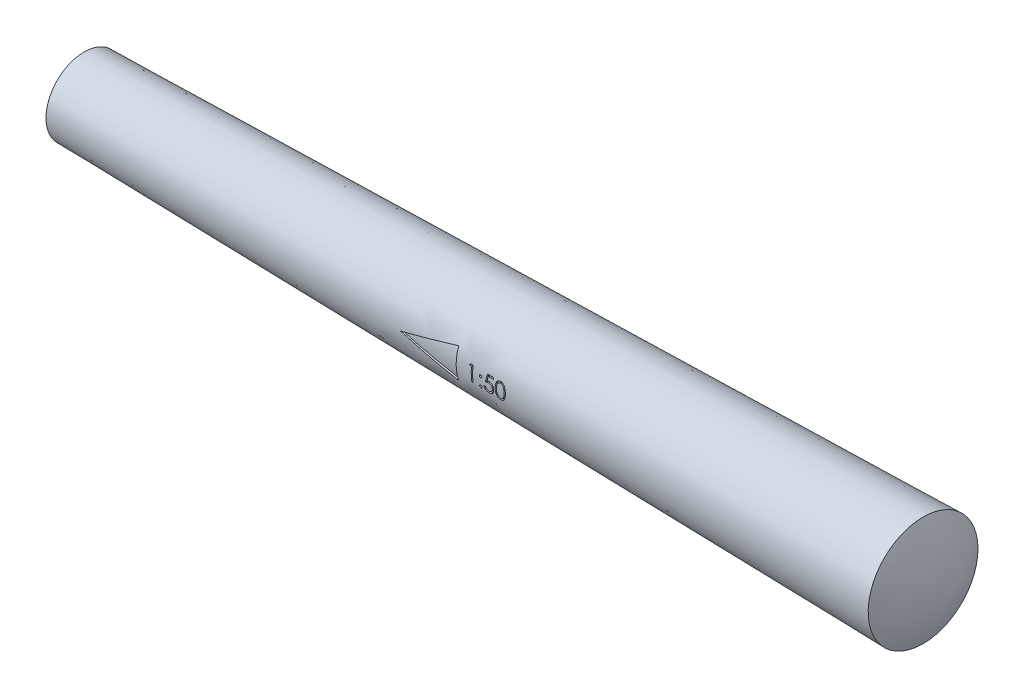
SolidWorks part; units mm, degrees
ref_plane "Front Plane" through (0, 0, 0) normal (0, 0, 1) x (1, 0, 0)
ref_plane "Top Plane" through (0, 0, 0) normal (0, 1, 0) x (1, 0, 0)
ref_plane "Right Plane" through (0, 0, 0) normal (1, 0, 0) x (0, 0, -1)
sketch "Sketch1" plane through (0, 0, 0) normal (1, 0, 0) x (0, 0, -1)
  circle A0 centre (0, 0) radius 2.5
  dimension "D1" = 5
extrude "Extrude1" add sketch "Sketch1" along normal mid plane 55
draft "Draft1" type of draft neutral plane draft angle 1.146 faces to draft 1 parameters "D1"=1.146
sketch "Sketch2" plane through (0, 0, 0) normal (0, 0, 1) x (1, 0, 0)
  line L0 (-27.5, 0) -> (-27.5, 2.5)
  line L1 (-27.5, 2.5) -> (-27.5, -2.5) construction
  line L2 (-27.5, 0) -> (-28.25, 0)
  line L3 (-28.25, 0) -> (-28.25, -3.05) construction
  line L4 (27.5, 0) -> (27.5, 3.6)
  line L5 (27.5, -3.6) -> (27.5, 3.6) construction
  line L6 (27.5, 0) -> (28.25, 0)
  line L7 (28.25, 0) -> (28.25, -3.05) construction
  line L8 (-27.5, -2.5) -> (27.5, -3.6) construction
  arc A0 (-28.25, 0) -> (-27.5, 2.5) centre (-23.7083, 0) cw
  arc A1 (28.25, 0) -> (27.5, 3.6) centre (19.2348, 0) ccw
  point P14 (0, -3.05)
revolve "Revolve1" add sketch "Sketch2" angle 360 about L2
sketch "Sketch5" plane through (0, 0, 0) normal (0, 0, 1) x (1, 0, 0)
  line L0 (0, 3.05) -> (0, -3.05) construction
  line L1 (27.5, 3.6) -> (-27.5, 2.5) construction
  line L2 (-27.5, -2.5) -> (27.5, -3.6) construction
ref_plane "Plane2" through (0, 0, 0) normal (-0.02, 0, 0.9998) x (0.9998, 0, 0.02)
sketch "Sketch6" plane through (0, 0, 0) normal (-0.02, 0, 0.9998) x (0.9998, 0, 0.02)
  line L0 (0, 0) -> (0, 1)
  line L1 (0, 3.05) -> (0, -3.05) construction
  line L2 (0, 1) -> (-3.7321, 0)
  line L3 (-3.7321, 0) -> (0, -1)
  line L4 (0, -1) -> (0, 0)
  line L5 (0, -0.5) -> (4, -0.5) construction
  text T0 "1:50" font "Century Gothic" height 1
  dimension "D1" = 2
  dimension "D2" = 30
  dimension "D3" = 4
wrap "Wrap2" sketch "Sketch6" wrap type deboss source sketch "Sketch6" thickness 0.1 parameters "D1"=0.1
equation "\"D2@Sketch2\" = \"D1@Sketch2\""
